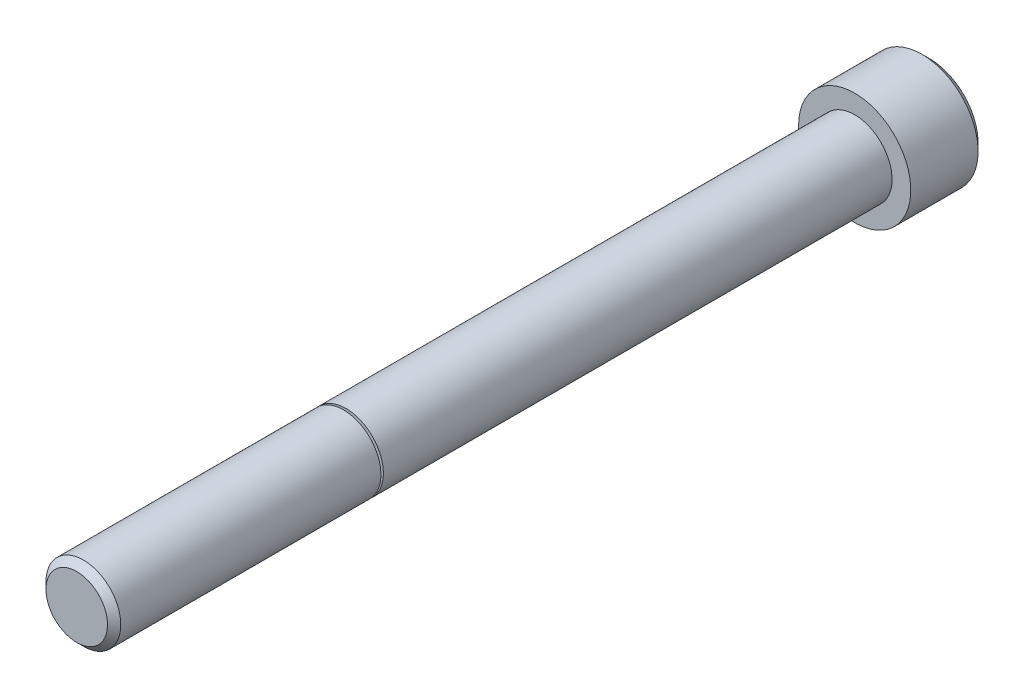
SolidWorks part; units mm, degrees
ref_plane "Front" through (0, 0, 0) normal (0, 0, 1) x (1, 0, 0)
ref_plane "Top" through (0, 0, 0) normal (0, 1, 0) x (1, 0, 0)
ref_plane "Right" through (0, 0, 0) normal (1, 0, 0) x (0, 0, -1)
sketch "Logo3_Revol_Axis" plane through (0, 0, 0) normal (0, 1, 0) x (1, 0, 0)
  line L0 (0, -43.5172) -> (0, 43.5172) construction
sketch "Logo3_bib1" plane through (0, 0, 0) normal (0, -1, 0) x (-1, 0, 0)
  line L0 (0, -82.55) -> (0, 7.9375)
  line L1 (0, 7.9375) -> (5.1594, 7.9375)
  line L2 (5.9531, 7.1437) -> (5.9531, 0)
  line L3 (5.9531, 0) -> (3.9688, 0)
  line L4 (3.9688, 0) -> (3.9688, -53.985)
  line L5 (3.9688, -81.8451) -> (3.2639, -82.55)
  line L6 (3.2639, -82.55) -> (0, -82.55)
  line L7 (3.9688, -53.985) -> (3.3773, -53.985)
  line L8 (3.3705, -54.0238) -> (3.9688, -54.2415)
  line L9 (3.9688, -54.2415) -> (3.9688, -81.8451)
  line L10 (0, 10.5852) -> (0, -63.2873) construction
  line L11 (5.1594, 7.9375) -> (5.9531, 7.1437)
  arc A1 (3.3773, -53.985) -> (3.3705, -54.0238) centre (3.3773, -54.005) ccw
  point P17 (3.2639, -53.985)
  point P19 (5.9531, 7.9375)
revolve "Revolve1" add sketch "Logo3_bib1" angle 360 about L10
sketch "Logo3_bib2" plane through (0, 0, -7.9375) normal (0, 0, -1) x (1, 0, 0)
  line L1 (3.6662, 0) -> (1.8331, 3.175)
  line L2 (1.8331, 3.175) -> (-1.8331, 3.175)
  line L3 (-1.8331, 3.175) -> (-3.6662, 0)
  line L4 (-3.6662, 0) -> (-1.8331, -3.175)
  line L5 (-1.8331, -3.175) -> (1.8331, -3.175)
  line L6 (1.8331, -3.175) -> (3.6662, 0)
  circle A0 centre (0, 0) radius 3.175 construction
  dimension "Logo3_c1" = 6.35
extrude "Cut-Extrude1" cut sketch "Logo3_bib2" against normal blind 3.9688
equation "\"DIA2@Logo3_bib1\" = \"Logo3_d1-pas@Logo3_bib1\""
equation "\"LGT1@Logo3_bib1\" = \"Logo3_d1@Logo3_bib1\""
equation "\"D1@Cut-Extrude1\" = \"Logo3_d1@Logo3_bib1\"/2."
equation "\"D2@Cosmetic Thread1\" = \"Logo3_d1-pas@Logo3_bib1\""
equation "\"D5@Logo3_bib1\"=\"Logo3_d1@Logo3_bib1\"*.1"
